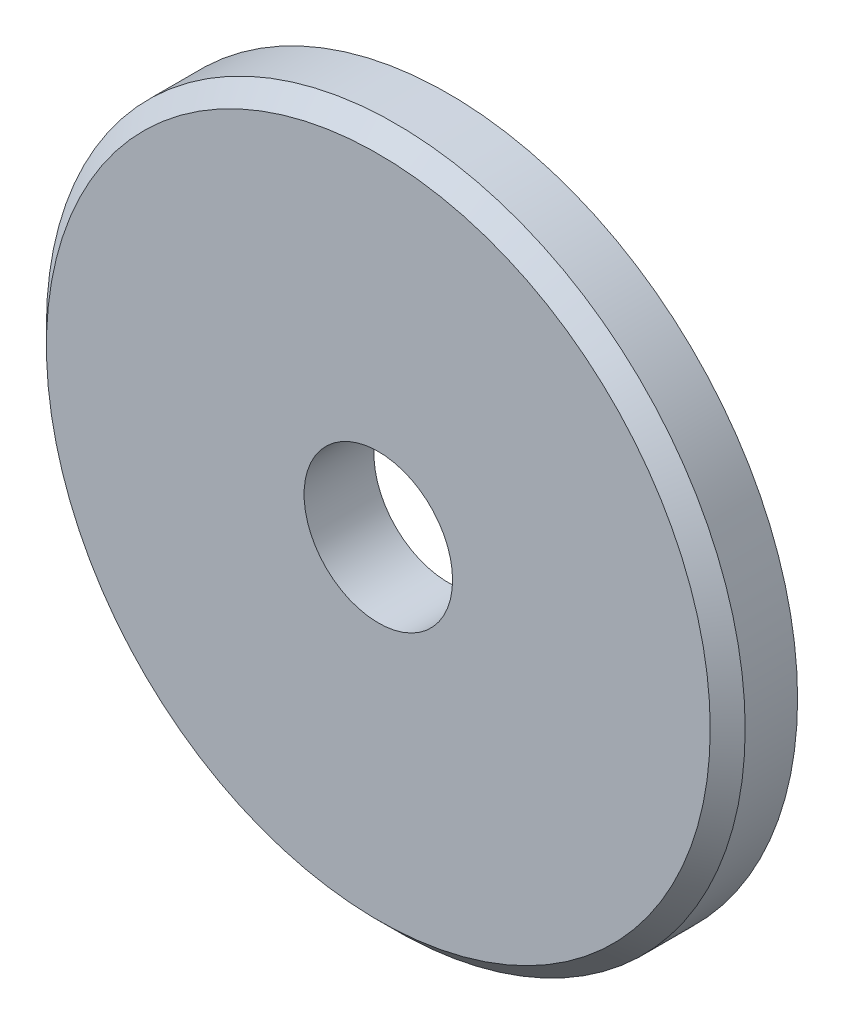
SolidWorks part; units mm, degrees
ref_plane "Face" through (0, 0, 0) normal (0, 0, 1) x (1, 0, 0)
ref_plane "Dessus" through (0, 0, 0) normal (0, 1, 0) x (1, 0, 0)
ref_plane "Droite" through (0, 0, 0) normal (1, 0, 0) x (0, 0, -1)
sketch "Esquisse1" plane through (0, 0, 0) normal (0, 0, 1) x (1, 0, 0)
  circle A0 centre (0, 0) radius 40
  circle A1 centre (0, 0) radius 8.5
  dimension "D1" = 17
  dimension "D2" = 80
extrude "Extrusion1" add sketch "Esquisse1" along normal blind 8
chamfer "Chanfrein1" distance 2 angle 45
